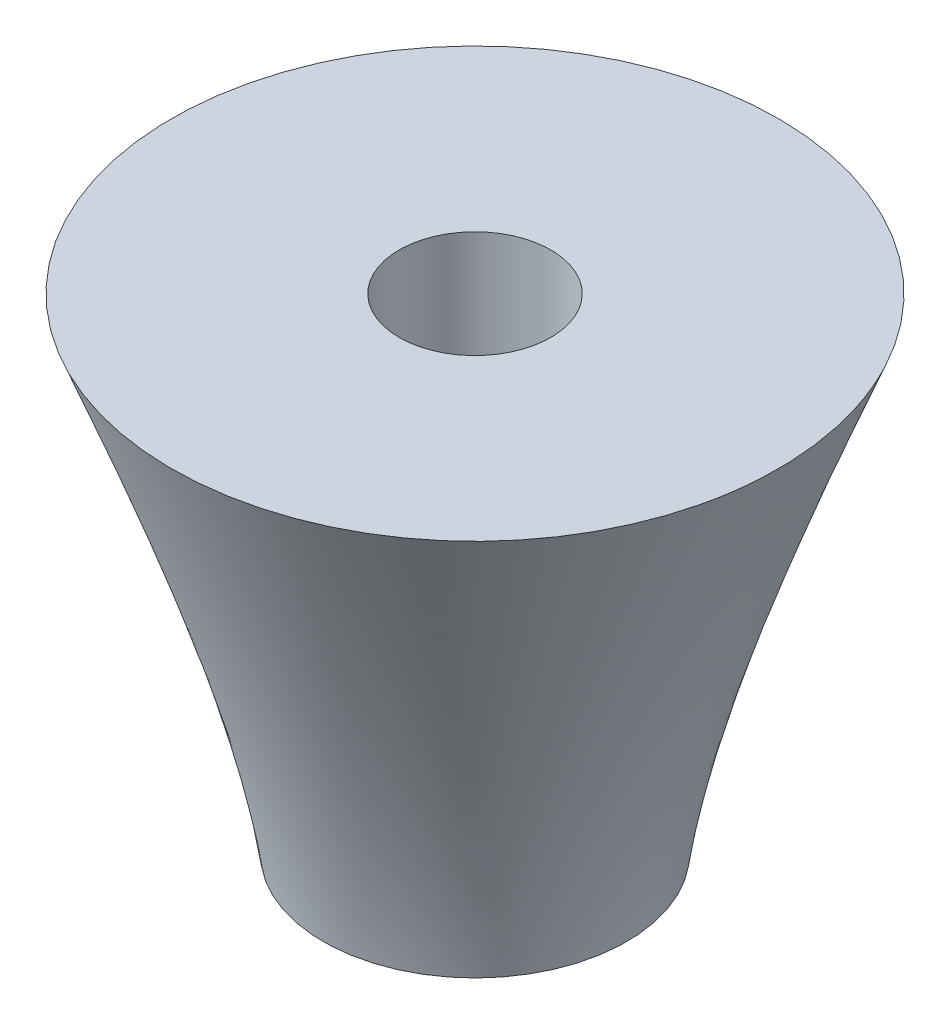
SolidWorks part; units mm, degrees
ref_plane "Front Plane" through (0, 0, 0) normal (0, 0, 1) x (1, 0, 0)
ref_plane "Top Plane" through (0, 0, 0) normal (0, 1, 0) x (1, 0, 0)
ref_plane "Right Plane" through (0, 0, 0) normal (1, 0, 0) x (0, 0, -1)
sketch "Sketch1" plane through (0, 0, 0) normal (0, 1, 0) x (1, 0, 0)
  circle A0 centre (0, 0) radius 3.175
  dimension "D1" = 6.35
ref_plane "Plane1" through (0, 10.16, 0) normal (0, 1, 0) x (1, 0, 0)
sketch "Sketch2" plane through (0, 10.16, 0) normal (0, 1, 0) x (1, 0, 0)
  circle A0 centre (0, 0) radius 6.35
  dimension "D1" = 12.7
loft "Loft1" add profiles "Sketch2", "Sketch1"
sketch "Sketch3" plane through (0, 10.16, 0) normal (0, 1, 0) x (1, 0, 0)
  circle A0 centre (0, 0) radius 1.5875
  dimension "D1" = 3.175
extrude "Cut-Extrude1" cut sketch "Sketch3" against normal through all
